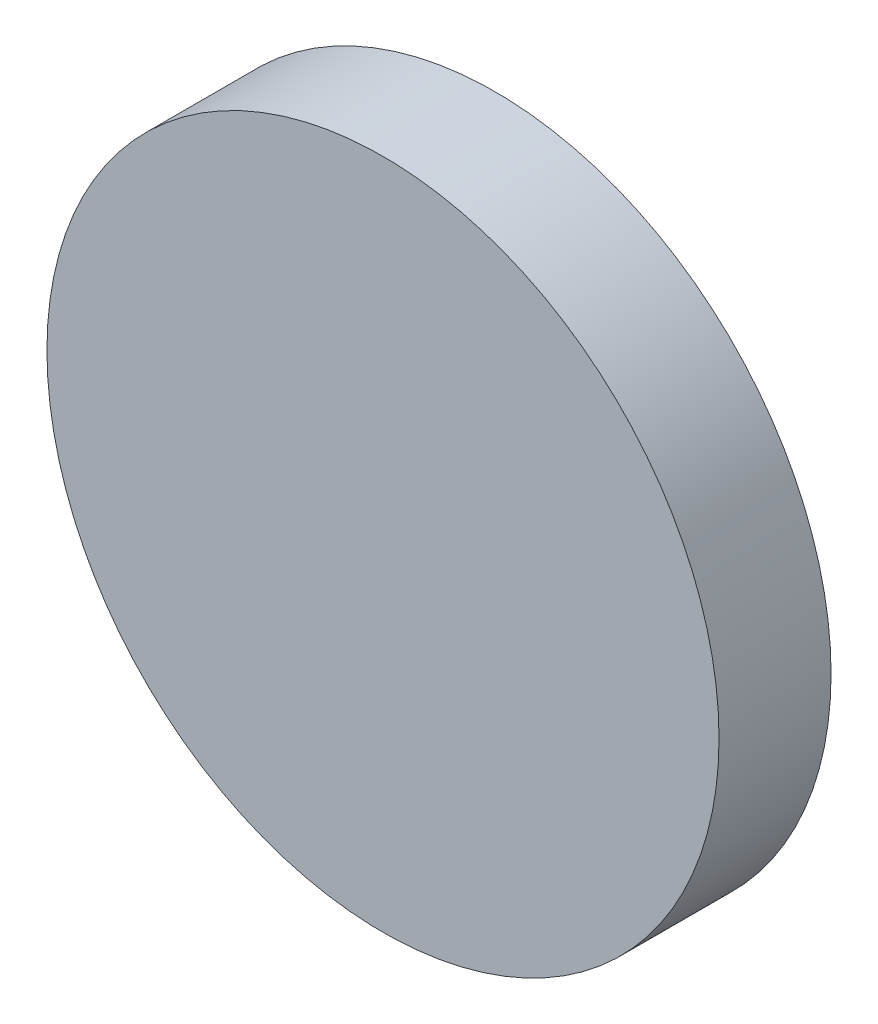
SolidWorks part; units mm, degrees
ref_plane "FACE" through (0, 0, 0) normal (0, 0, 1) x (1, 0, 0)
ref_plane "DESSUS" through (0, 0, 0) normal (0, 1, 0) x (1, 0, 0)
ref_plane "GAUCHE" through (0, 0, 0) normal (1, 0, 0) x (0, 0, -1)
sketch "Esquisse1" plane through (0, 0, 0) normal (0, 0, 1) x (1, 0, 0)
  circle A0 centre (0, 0) radius 12
  dimension "D1" = 24
extrude "Base-Extrusion" add sketch "Esquisse1" along normal blind 4
